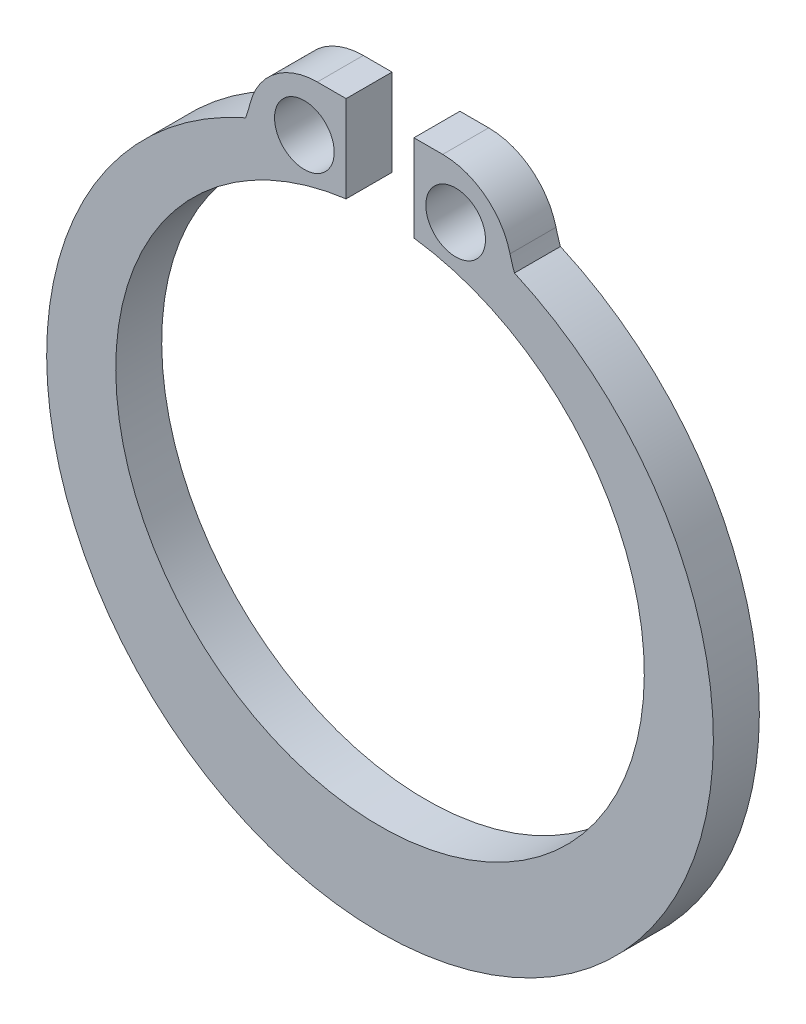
SolidWorks part; units mm, degrees
ref_plane "Plane1" through (0, 0, 0) normal (0, 0, 1) x (1, 0, 0)
ref_plane "Plane2" through (0, 0, 0) normal (0, 1, 0) x (1, 0, 0)
ref_plane "Plane3" through (0, 0, 0) normal (1, 0, 0) x (0, 0, -1)
sketch "Esquisse1" plane through (0, 0, 0) normal (0, 0, 1) x (1, 0, 0)
  line L0 (0, 0) -> (0, 16.383) construction
  line L1 (-0.738, 8.0922) -> (-0.738, 6.2024)
  line L2 (0.738, 8.0922) -> (0.738, 6.2024)
  line L3 (0.738, 8.0922) -> (1.364, 8.0922)
  line L4 (-0.738, 8.0922) -> (-1.364, 8.0922)
  circle A0 centre (-1.6461, 6.9511) radius 0.6492
  circle A1 centre (0, 0) radius 9.8 construction
  circle A2 centre (1.6461, 6.9511) radius 0.6492
  arc A3 (1.364, 8.0922) -> (2.8287, 6.9511) centre (1.364, 6.5816) cw
  arc A4 (-1.364, 8.0922) -> (-2.8287, 6.9511) centre (-1.364, 6.5816) ccw
  arc A5 (-2.925, 6.637) -> (2.925, 6.637) centre (0, 0) ccw
  arc A6 (-0.738, 6.2024) -> (0.738, 6.2024) centre (0, 0.5) ccw
  arc A7 (2.8287, 6.9511) -> (2.925, 6.637) centre (5.9807, 7.7463) ccw
  arc A8 (-2.8287, 6.9511) -> (-2.925, 6.637) centre (-5.9807, 7.7463) cw
  dimension "D1" = 19.6
  dimension "D4" = 5.75
  dimension "D3" = 0.5
extrude "Base-Extrusion" add sketch "Esquisse1" along normal blind 1
